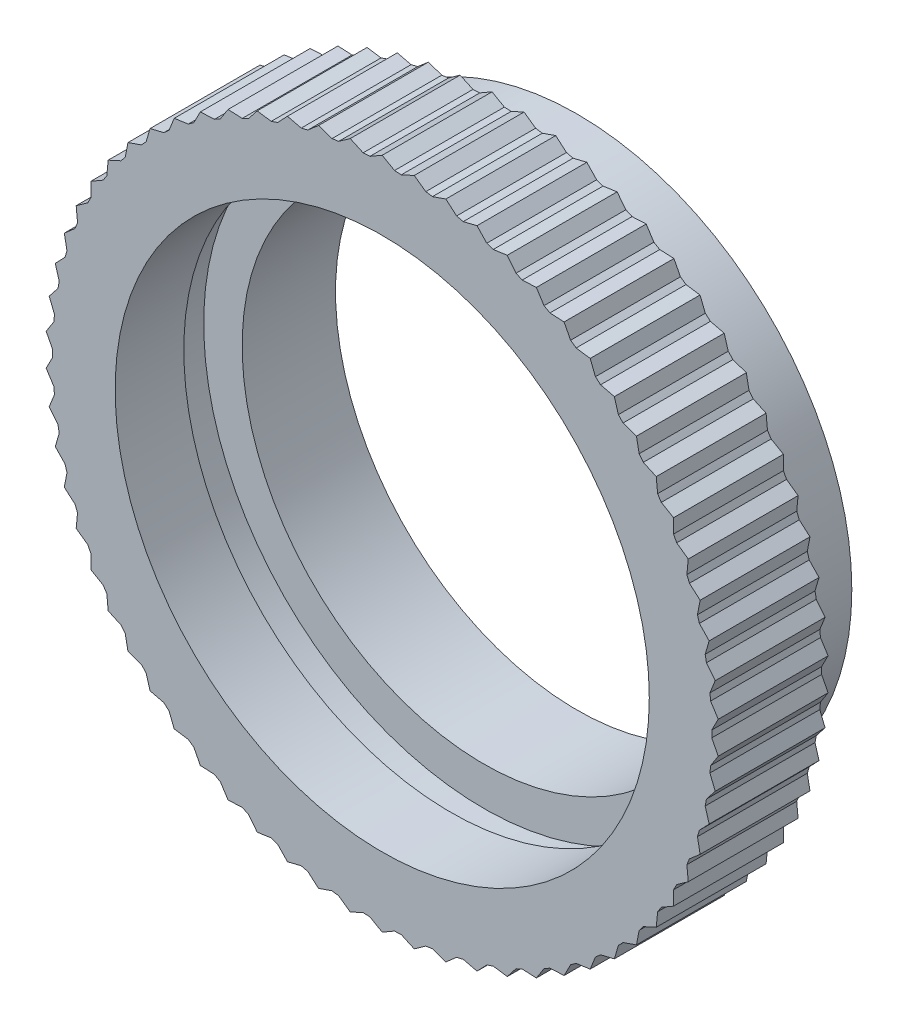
SolidWorks part; units mm, degrees
ref_plane "Front Plane" through (0, 0, 0) normal (0, 0, 1) x (1, 0, 0)
ref_plane "Top Plane" through (0, 0, 0) normal (0, 1, 0) x (1, 0, 0)
ref_plane "Right Plane" through (0, 0, 0) normal (1, 0, 0) x (0, 0, -1)
sketch "Sketch2" plane through (0, 0, 0) normal (1, 0, 0) x (0, 0, -1)
  line L0 (-11.5966, 0) -> (15.0623, 0) construction
  line L1 (0, 15.24) -> (5.08, 15.24)
  line L2 (5.08, 15.24) -> (5.08, 12.065)
  line L3 (5.08, 12.065) -> (6.477, 12.065)
  line L4 (6.477, 12.065) -> (6.477, 12.7)
  line L5 (6.477, 12.7) -> (9.017, 12.7)
  line L7 (9.017, 12.7) -> (9.017, 11.176)
  line L8 (9.017, 11.176) -> (4.699, 11.176)
  line L9 (4.699, 11.176) -> (4.699, 12.954)
  line L10 (4.699, 12.954) -> (3.175, 12.954)
  line L11 (3.175, 12.954) -> (3.175, 12.3508)
  line L12 (3.175, 12.3508) -> (0, 12.3508)
  line L14 (0, 12.3508) -> (0, 15.24)
  dimension "D1" = 30.48
  dimension "D2" = 24.7015
  dimension "D3" = 25.908
  dimension "D4" = 24.13
  dimension "D5" = 25.4
  dimension "D6" = 22.352
  dimension "D7" = 5.08
  dimension "D8" = 4.699
  dimension "D9" = 3.175
  dimension "D10" = 3.937
  dimension "D11" = 2.54
revolve "Revolve1" add sketch "Sketch2" angle 360 about L0
sketch "Sketch3" plane through (0, 0, 0) normal (0, 0, 1) x (1, 0, 0)
  line L1 (13.4732, 7.7788) -> (0, 15.5575)
  line L2 (0, 15.5575) -> (-13.4732, 7.7787)
  line L3 (-13.4732, 7.7787) -> (-13.4732, -7.7788)
  line L4 (-13.4732, -7.7788) -> (0, -15.5575)
  line L5 (0, -15.5575) -> (13.4732, -7.7787)
  line L6 (13.4732, -7.7787) -> (13.4732, 7.7788)
  circle A0 centre (0, 0) radius 13.4732 construction
  dimension "D1" = 31.115
extrude "Boss-Extrude1" add sketch "Sketch3" against normal up to surface (5.08 mm away) contours L1 L2 M2 | L6 L1 M2 | L5 L6 M2 | L4 L5 M2 | L3 L4 M2 | L2 L3 M2
pattern_circular "CirPattern1" count 11 over 360 about axis through (0, 0, 0) along (0, 0, 1) of "Boss-Extrude1"
